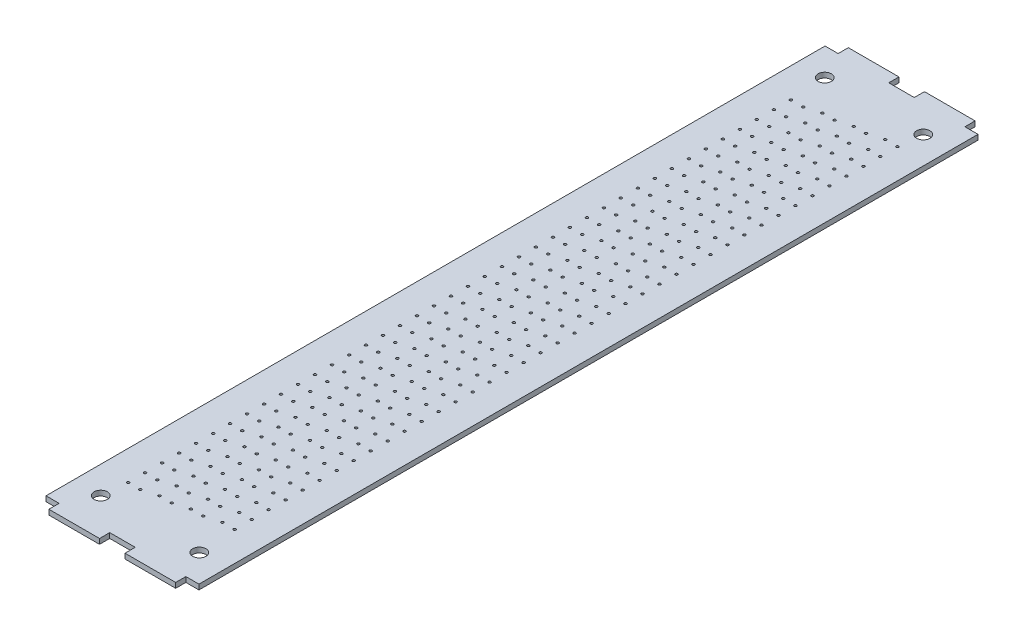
SolidWorks part; units mm, degrees
ref_plane "Alzado" through (0, 0, 0) normal (0, 0, 1) x (1, 0, 0)
ref_plane "Planta" through (0, 0, 0) normal (0, 1, 0) x (1, 0, 0)
ref_plane "Vista lateral" through (0, 0, 0) normal (1, 0, 0) x (0, 0, -1)
sketch "Croquis1" plane through (0, 0, 0) normal (0, 1, 0) x (1, 0, 0)
  line L0 (0, 458.4) -> (7.7, 458.4) construction
  line L1 (0, 0) -> (7.7, 0)
  line L2 (0, 0) -> (0, 458.4)
  line L3 (0, 458.4) -> (7.7, 458.4)
  line L4 (90, 0) -> (90, 458.4)
  line L5 (37.5, 458.4) -> (52.5, 458.4) construction
  line L6 (37.5, 0) -> (52.5, 0)
  line L7 (7.7, 458.4) -> (7.7, 464.4)
  line L8 (7.7, 464.4) -> (37.5, 464.4)
  line L9 (37.5, 458.4) -> (37.5, 464.4)
  line L10 (37.5, 458.4) -> (52.5, 458.4)
  line L11 (82.3, 0) -> (90, 0)
  line L12 (52.5, 458.4) -> (52.5, 464.4)
  line L13 (52.5, 464.4) -> (82.3, 464.4)
  line L14 (82.3, 458.4) -> (82.3, 464.4)
  line L15 (82.3, 458.4) -> (90, 458.4)
  line L16 (7.7, 0) -> (7.7, -6)
  line L17 (7.7, -6) -> (37.5, -6)
  line L18 (37.5, 0) -> (37.5, -6)
  line L20 (82.3, 0) -> (82.3, -6)
  line L21 (82.3, -6) -> (52.5, -6)
  line L22 (52.5, 0) -> (52.5, -6)
  circle A0 centre (16, 442.2) radius 3.9
  circle A1 centre (74, 442.2) radius 3.9
  circle A2 centre (16, 16.2) radius 3.9
  circle A3 centre (74, 16.2) radius 3.9
  circle A4 centre (72.6, 38.4) radius 0.75
  circle A5 centre (65.4, 38.4) radius 0.75
  circle A6 centre (56.6, 35.9) radius 0.75
  circle A7 centre (49.4, 35.9) radius 0.75
  circle A8 centre (40.6, 33.4) radius 0.75
  circle A9 centre (33.4, 33.4) radius 0.75
  circle A10 centre (24.6, 30.9) radius 0.75
  circle A11 centre (17.4, 30.9) radius 0.75
  circle A12 centre (17.4, 40.9) radius 0.75
  circle A13 centre (24.6, 40.9) radius 0.75
  circle A14 centre (33.4, 43.4) radius 0.75
  circle A15 centre (40.6, 43.4) radius 0.75
  circle A16 centre (49.4, 45.9) radius 0.75
  circle A17 centre (56.6, 45.9) radius 0.75
  circle A18 centre (65.4, 48.4) radius 0.75
  circle A19 centre (72.6, 48.4) radius 0.75
  circle A20 centre (17.4, 50.9) radius 0.75
  circle A21 centre (24.6, 50.9) radius 0.75
  circle A22 centre (33.4, 53.4) radius 0.75
  circle A23 centre (40.6, 53.4) radius 0.75
  circle A24 centre (49.4, 55.9) radius 0.75
  circle A25 centre (56.6, 55.9) radius 0.75
  circle A26 centre (65.4, 58.4) radius 0.75
  circle A27 centre (72.6, 58.4) radius 0.75
  circle A28 centre (17.4, 60.9) radius 0.75
  circle A29 centre (24.6, 60.9) radius 0.75
  circle A30 centre (33.4, 63.4) radius 0.75
  circle A31 centre (40.6, 63.4) radius 0.75
  circle A32 centre (49.4, 65.9) radius 0.75
  circle A33 centre (56.6, 65.9) radius 0.75
  circle A34 centre (65.4, 68.4) radius 0.75
  circle A35 centre (72.6, 68.4) radius 0.75
  circle A36 centre (17.4, 70.9) radius 0.75
  circle A37 centre (24.6, 70.9) radius 0.75
  circle A38 centre (33.4, 73.4) radius 0.75
  circle A39 centre (40.6, 73.4) radius 0.75
  circle A40 centre (49.4, 75.9) radius 0.75
  circle A41 centre (56.6, 75.9) radius 0.75
  circle A42 centre (65.4, 78.4) radius 0.75
  circle A43 centre (72.6, 78.4) radius 0.75
  circle A44 centre (17.4, 80.9) radius 0.75
  circle A45 centre (24.6, 80.9) radius 0.75
  circle A46 centre (33.4, 83.4) radius 0.75
  circle A47 centre (40.6, 83.4) radius 0.75
  circle A48 centre (49.4, 85.9) radius 0.75
  circle A49 centre (56.6, 85.9) radius 0.75
  circle A50 centre (65.4, 88.4) radius 0.75
  circle A51 centre (72.6, 88.4) radius 0.75
  circle A52 centre (17.4, 90.9) radius 0.75
  circle A53 centre (24.6, 90.9) radius 0.75
  circle A54 centre (33.4, 93.4) radius 0.75
  circle A55 centre (40.6, 93.4) radius 0.75
  circle A56 centre (49.4, 95.9) radius 0.75
  circle A57 centre (56.6, 95.9) radius 0.75
  circle A58 centre (65.4, 98.4) radius 0.75
  circle A59 centre (72.6, 98.4) radius 0.75
  circle A60 centre (17.4, 100.9) radius 0.75
  circle A61 centre (24.6, 100.9) radius 0.75
  circle A62 centre (33.4, 103.4) radius 0.75
  circle A63 centre (40.6, 103.4) radius 0.75
  circle A64 centre (49.4, 105.9) radius 0.75
  circle A65 centre (56.6, 105.9) radius 0.75
  circle A66 centre (65.4, 108.4) radius 0.75
  circle A67 centre (72.6, 108.4) radius 0.75
  circle A68 centre (17.4, 110.9) radius 0.75
  circle A69 centre (24.6, 110.9) radius 0.75
  circle A70 centre (33.4, 113.4) radius 0.75
  circle A71 centre (40.6, 113.4) radius 0.75
  circle A72 centre (49.4, 115.9) radius 0.75
  circle A73 centre (56.6, 115.9) radius 0.75
  circle A74 centre (65.4, 118.4) radius 0.75
  circle A75 centre (72.6, 118.4) radius 0.75
  circle A76 centre (17.4, 120.9) radius 0.75
  circle A77 centre (24.6, 120.9) radius 0.75
  circle A78 centre (33.4, 123.4) radius 0.75
  circle A79 centre (40.6, 123.4) radius 0.75
  circle A80 centre (49.4, 125.9) radius 0.75
  circle A81 centre (56.6, 125.9) radius 0.75
  circle A82 centre (65.4, 128.4) radius 0.75
  circle A83 centre (72.6, 128.4) radius 0.75
  circle A84 centre (17.4, 130.9) radius 0.75
  circle A85 centre (24.6, 130.9) radius 0.75
  circle A86 centre (33.4, 133.4) radius 0.75
  circle A87 centre (40.6, 133.4) radius 0.75
  circle A88 centre (49.4, 135.9) radius 0.75
  circle A89 centre (56.6, 135.9) radius 0.75
  circle A90 centre (65.4, 138.4) radius 0.75
  circle A91 centre (72.6, 138.4) radius 0.75
  circle A92 centre (17.4, 140.9) radius 0.75
  circle A93 centre (24.6, 140.9) radius 0.75
  circle A94 centre (33.4, 143.4) radius 0.75
  circle A95 centre (40.6, 143.4) radius 0.75
  circle A96 centre (49.4, 145.9) radius 0.75
  circle A97 centre (56.6, 145.9) radius 0.75
  circle A98 centre (65.4, 148.4) radius 0.75
  circle A99 centre (72.6, 148.4) radius 0.75
  circle A100 centre (17.4, 150.9) radius 0.75
  circle A101 centre (24.6, 150.9) radius 0.75
  circle A102 centre (33.4, 153.4) radius 0.75
  circle A103 centre (40.6, 153.4) radius 0.75
  circle A104 centre (49.4, 155.9) radius 0.75
  circle A105 centre (56.6, 155.9) radius 0.75
  circle A106 centre (65.4, 158.4) radius 0.75
  circle A107 centre (72.6, 158.4) radius 0.75
  circle A108 centre (17.4, 160.9) radius 0.75
  circle A109 centre (24.6, 160.9) radius 0.75
  circle A110 centre (33.4, 163.4) radius 0.75
  circle A111 centre (40.6, 163.4) radius 0.75
  circle A112 centre (49.4, 165.9) radius 0.75
  circle A113 centre (56.6, 165.9) radius 0.75
  circle A114 centre (65.4, 168.4) radius 0.75
  circle A115 centre (72.6, 168.4) radius 0.75
  circle A116 centre (17.4, 170.9) radius 0.75
  circle A117 centre (24.6, 170.9) radius 0.75
  circle A118 centre (33.4, 173.4) radius 0.75
  circle A119 centre (40.6, 173.4) radius 0.75
  circle A120 centre (49.4, 175.9) radius 0.75
  circle A121 centre (56.6, 175.9) radius 0.75
  circle A122 centre (65.4, 178.4) radius 0.75
  circle A123 centre (72.6, 178.4) radius 0.75
  circle A124 centre (17.4, 180.9) radius 0.75
  circle A125 centre (24.6, 180.9) radius 0.75
  circle A126 centre (33.4, 183.4) radius 0.75
  circle A127 centre (40.6, 183.4) radius 0.75
  circle A128 centre (49.4, 185.9) radius 0.75
  circle A129 centre (56.6, 185.9) radius 0.75
  circle A130 centre (65.4, 188.4) radius 0.75
  circle A131 centre (72.6, 188.4) radius 0.75
  circle A132 centre (17.4, 190.9) radius 0.75
  circle A133 centre (24.6, 190.9) radius 0.75
  circle A134 centre (33.4, 193.4) radius 0.75
  circle A135 centre (40.6, 193.4) radius 0.75
  circle A136 centre (49.4, 195.9) radius 0.75
  circle A137 centre (56.6, 195.9) radius 0.75
  circle A138 centre (65.4, 198.4) radius 0.75
  circle A139 centre (72.6, 198.4) radius 0.75
  circle A140 centre (17.4, 200.9) radius 0.75
  circle A141 centre (24.6, 200.9) radius 0.75
  circle A142 centre (33.4, 203.4) radius 0.75
  circle A143 centre (40.6, 203.4) radius 0.75
  circle A144 centre (49.4, 205.9) radius 0.75
  circle A145 centre (56.6, 205.9) radius 0.75
  circle A146 centre (65.4, 208.4) radius 0.75
  circle A147 centre (72.6, 208.4) radius 0.75
  circle A148 centre (17.4, 210.9) radius 0.75
  circle A149 centre (24.6, 210.9) radius 0.75
  circle A150 centre (33.4, 213.4) radius 0.75
  circle A151 centre (40.6, 213.4) radius 0.75
  circle A152 centre (49.4, 215.9) radius 0.75
  circle A153 centre (56.6, 215.9) radius 0.75
  circle A154 centre (65.4, 218.4) radius 0.75
  circle A155 centre (72.6, 218.4) radius 0.75
  circle A156 centre (17.4, 220.9) radius 0.75
  circle A157 centre (24.6, 220.9) radius 0.75
  circle A158 centre (33.4, 223.4) radius 0.75
  circle A159 centre (40.6, 223.4) radius 0.75
  circle A160 centre (49.4, 225.9) radius 0.75
  circle A161 centre (56.6, 225.9) radius 0.75
  circle A162 centre (65.4, 228.4) radius 0.75
  circle A163 centre (72.6, 228.4) radius 0.75
  circle A164 centre (17.4, 230.9) radius 0.75
  circle A165 centre (24.6, 230.9) radius 0.75
  circle A166 centre (33.4, 233.4) radius 0.75
  circle A167 centre (40.6, 233.4) radius 0.75
  circle A168 centre (49.4, 235.9) radius 0.75
  circle A169 centre (56.6, 235.9) radius 0.75
  circle A170 centre (65.4, 238.4) radius 0.75
  circle A171 centre (72.6, 238.4) radius 0.75
  circle A172 centre (17.4, 240.9) radius 0.75
  circle A173 centre (24.6, 240.9) radius 0.75
  circle A174 centre (33.4, 243.4) radius 0.75
  circle A175 centre (40.6, 243.4) radius 0.75
  circle A176 centre (49.4, 245.9) radius 0.75
  circle A177 centre (56.6, 245.9) radius 0.75
  circle A178 centre (65.4, 248.4) radius 0.75
  circle A179 centre (72.6, 248.4) radius 0.75
  circle A180 centre (17.4, 250.9) radius 0.75
  circle A181 centre (24.6, 250.9) radius 0.75
  circle A182 centre (33.4, 253.4) radius 0.75
  circle A183 centre (40.6, 253.4) radius 0.75
  circle A184 centre (49.4, 255.9) radius 0.75
  circle A185 centre (56.6, 255.9) radius 0.75
  circle A186 centre (65.4, 258.4) radius 0.75
  circle A187 centre (72.6, 258.4) radius 0.75
  circle A188 centre (17.4, 260.9) radius 0.75
  circle A189 centre (24.6, 260.9) radius 0.75
  circle A190 centre (33.4, 263.4) radius 0.75
  circle A191 centre (40.6, 263.4) radius 0.75
  circle A192 centre (49.4, 265.9) radius 0.75
  circle A193 centre (56.6, 265.9) radius 0.75
  circle A194 centre (65.4, 268.4) radius 0.75
  circle A195 centre (72.6, 268.4) radius 0.75
  circle A196 centre (17.4, 270.9) radius 0.75
  circle A197 centre (24.6, 270.9) radius 0.75
  circle A198 centre (33.4, 273.4) radius 0.75
  circle A199 centre (40.6, 273.4) radius 0.75
  circle A200 centre (49.4, 275.9) radius 0.75
  circle A201 centre (56.6, 275.9) radius 0.75
  circle A202 centre (65.4, 278.4) radius 0.75
  circle A203 centre (72.6, 278.4) radius 0.75
  circle A204 centre (17.4, 280.9) radius 0.75
  circle A205 centre (24.6, 280.9) radius 0.75
  circle A206 centre (33.4, 283.4) radius 0.75
  circle A207 centre (40.6, 283.4) radius 0.75
  circle A208 centre (49.4, 285.9) radius 0.75
  circle A209 centre (56.6, 285.9) radius 0.75
  circle A210 centre (65.4, 288.4) radius 0.75
  circle A211 centre (72.6, 288.4) radius 0.75
  circle A212 centre (17.4, 290.9) radius 0.75
  circle A213 centre (24.6, 290.9) radius 0.75
  circle A214 centre (33.4, 293.4) radius 0.75
  circle A215 centre (40.6, 293.4) radius 0.75
  circle A216 centre (49.4, 295.9) radius 0.75
  circle A217 centre (56.6, 295.9) radius 0.75
  circle A218 centre (65.4, 298.4) radius 0.75
  circle A219 centre (72.6, 298.4) radius 0.75
  circle A220 centre (17.4, 300.9) radius 0.75
  circle A221 centre (24.6, 300.9) radius 0.75
  circle A222 centre (33.4, 303.4) radius 0.75
  circle A223 centre (40.6, 303.4) radius 0.75
  circle A224 centre (49.4, 305.9) radius 0.75
  circle A225 centre (56.6, 305.9) radius 0.75
  circle A226 centre (65.4, 308.4) radius 0.75
  circle A227 centre (72.6, 308.4) radius 0.75
  circle A228 centre (17.4, 310.9) radius 0.75
  circle A229 centre (24.6, 310.9) radius 0.75
  circle A230 centre (33.4, 313.4) radius 0.75
  circle A231 centre (40.6, 313.4) radius 0.75
  circle A232 centre (49.4, 315.9) radius 0.75
  circle A233 centre (56.6, 315.9) radius 0.75
  circle A234 centre (65.4, 318.4) radius 0.75
  circle A235 centre (72.6, 318.4) radius 0.75
  circle A236 centre (17.4, 320.9) radius 0.75
  circle A237 centre (24.6, 320.9) radius 0.75
  circle A238 centre (33.4, 323.4) radius 0.75
  circle A239 centre (40.6, 323.4) radius 0.75
  circle A240 centre (49.4, 325.9) radius 0.75
  circle A241 centre (56.6, 325.9) radius 0.75
  circle A242 centre (65.4, 328.4) radius 0.75
  circle A243 centre (72.6, 328.4) radius 0.75
  circle A244 centre (17.4, 330.9) radius 0.75
  circle A245 centre (24.6, 330.9) radius 0.75
  circle A246 centre (33.4, 333.4) radius 0.75
  circle A247 centre (40.6, 333.4) radius 0.75
  circle A248 centre (49.4, 335.9) radius 0.75
  circle A249 centre (56.6, 335.9) radius 0.75
  circle A250 centre (65.4, 338.4) radius 0.75
  circle A251 centre (72.6, 338.4) radius 0.75
  circle A252 centre (17.4, 340.9) radius 0.75
  circle A253 centre (24.6, 340.9) radius 0.75
  circle A254 centre (33.4, 343.4) radius 0.75
  circle A255 centre (40.6, 343.4) radius 0.75
  circle A256 centre (49.4, 345.9) radius 0.75
  circle A257 centre (56.6, 345.9) radius 0.75
  circle A258 centre (65.4, 348.4) radius 0.75
  circle A259 centre (72.6, 348.4) radius 0.75
  circle A260 centre (17.4, 350.9) radius 0.75
  circle A261 centre (24.6, 350.9) radius 0.75
  circle A262 centre (33.4, 353.4) radius 0.75
  circle A263 centre (40.6, 353.4) radius 0.75
  circle A264 centre (49.4, 355.9) radius 0.75
  circle A265 centre (56.6, 355.9) radius 0.75
  circle A266 centre (65.4, 358.4) radius 0.75
  circle A267 centre (72.6, 358.4) radius 0.75
  circle A268 centre (17.4, 360.9) radius 0.75
  circle A269 centre (24.6, 360.9) radius 0.75
  circle A270 centre (33.4, 363.4) radius 0.75
  circle A271 centre (40.6, 363.4) radius 0.75
  circle A272 centre (49.4, 365.9) radius 0.75
  circle A273 centre (56.6, 365.9) radius 0.75
  circle A274 centre (65.4, 368.4) radius 0.75
  circle A275 centre (72.6, 368.4) radius 0.75
  circle A276 centre (17.4, 370.9) radius 0.75
  circle A277 centre (24.6, 370.9) radius 0.75
  circle A278 centre (33.4, 373.4) radius 0.75
  circle A279 centre (40.6, 373.4) radius 0.75
  circle A280 centre (49.4, 375.9) radius 0.75
  circle A281 centre (56.6, 375.9) radius 0.75
  circle A282 centre (65.4, 378.4) radius 0.75
  circle A283 centre (72.6, 378.4) radius 0.75
  circle A284 centre (17.4, 380.9) radius 0.75
  circle A285 centre (24.6, 380.9) radius 0.75
  circle A286 centre (33.4, 383.4) radius 0.75
  circle A287 centre (40.6, 383.4) radius 0.75
  circle A288 centre (49.4, 385.9) radius 0.75
  circle A289 centre (56.6, 385.9) radius 0.75
  circle A290 centre (65.4, 388.4) radius 0.75
  circle A291 centre (72.6, 388.4) radius 0.75
  circle A292 centre (17.4, 390.9) radius 0.75
  circle A293 centre (24.6, 390.9) radius 0.75
  circle A294 centre (33.4, 393.4) radius 0.75
  circle A295 centre (40.6, 393.4) radius 0.75
  circle A296 centre (49.4, 395.9) radius 0.75
  circle A297 centre (56.6, 395.9) radius 0.75
  circle A298 centre (65.4, 398.4) radius 0.75
  circle A299 centre (72.6, 398.4) radius 0.75
  circle A300 centre (17.4, 400.9) radius 0.75
  circle A301 centre (24.6, 400.9) radius 0.75
  circle A302 centre (33.4, 403.4) radius 0.75
  circle A303 centre (40.6, 403.4) radius 0.75
  circle A304 centre (49.4, 405.9) radius 0.75
  circle A305 centre (56.6, 405.9) radius 0.75
  circle A306 centre (65.4, 408.4) radius 0.75
  circle A307 centre (72.6, 408.4) radius 0.75
  circle A308 centre (17.4, 410.9) radius 0.75
  circle A309 centre (24.6, 410.9) radius 0.75
  circle A310 centre (33.4, 413.4) radius 0.75
  circle A311 centre (40.6, 413.4) radius 0.75
  circle A312 centre (49.4, 415.9) radius 0.75
  circle A313 centre (56.6, 415.9) radius 0.75
  circle A314 centre (65.4, 418.4) radius 0.75
  circle A315 centre (72.6, 418.4) radius 0.75
  circle A316 centre (17.4, 420.9) radius 0.75
  circle A317 centre (24.6, 420.9) radius 0.75
  circle A318 centre (33.4, 423.4) radius 0.75
  circle A319 centre (40.6, 423.4) radius 0.75
  circle A320 centre (49.4, 425.9) radius 0.75
  circle A321 centre (56.6, 425.9) radius 0.75
  circle A322 centre (65.4, 428.4) radius 0.75
  circle A323 centre (72.6, 428.4) radius 0.75
  dimension "D15" = 7.8
  dimension "D16" = 16
  dimension "D18" = 7.8
  dimension "D21" = 7.8
  dimension "D24" = 7.8
  dimension "D27" = 1.5
  dimension "D30" = 1.5
  dimension "D33" = 8.8
  dimension "D34" = 2.5
  dimension "D35" = 1.5
  dimension "D36" = 7.2
  dimension "D37" = 1.5
  dimension "D38" = 35.9
  dimension "D39" = 8.8
  dimension "D40" = 2.5
  dimension "D41" = 1.5
  dimension "D42" = 1.5
  dimension "D43" = 7.2
  dimension "D44" = 33.4
  dimension "D45" = 2.5
  dimension "D46" = 8.8
  dimension "D47" = 1.5
  dimension "D48" = 1.5
  dimension "D49" = 7.2
  dimension "D50" = 30.9
  dimension "D1" = 458.4
  dimension "D2" = 90
  dimension "D3" = 7.7
  dimension "D4" = 6
  dimension "D5" = 29.8
  dimension "D6" = 15
  dimension "D7" = 29.8
  dimension "D8" = 6
  dimension "D9" = 6
  dimension "D10" = 29.8
  dimension "D11" = 29.8
  dimension "D12" = 6
  dimension "D13" = 15
  dimension "D14" = 7.7
  dimension "D17" = 16.2
  dimension "D19" = 16
  dimension "D20" = 16.2
  dimension "D22" = 16
  dimension "D23" = 16.2
  dimension "D25" = 16
  dimension "D26" = 16.2
  dimension "D28" = 17.4
  dimension "D29" = 38.4
  dimension "D31" = 7.2
  dimension "D32" = 24.6
  dimension "D51" = 40
extrude "Saliente-Extruir1" add sketch "Croquis1" along normal blind 3
